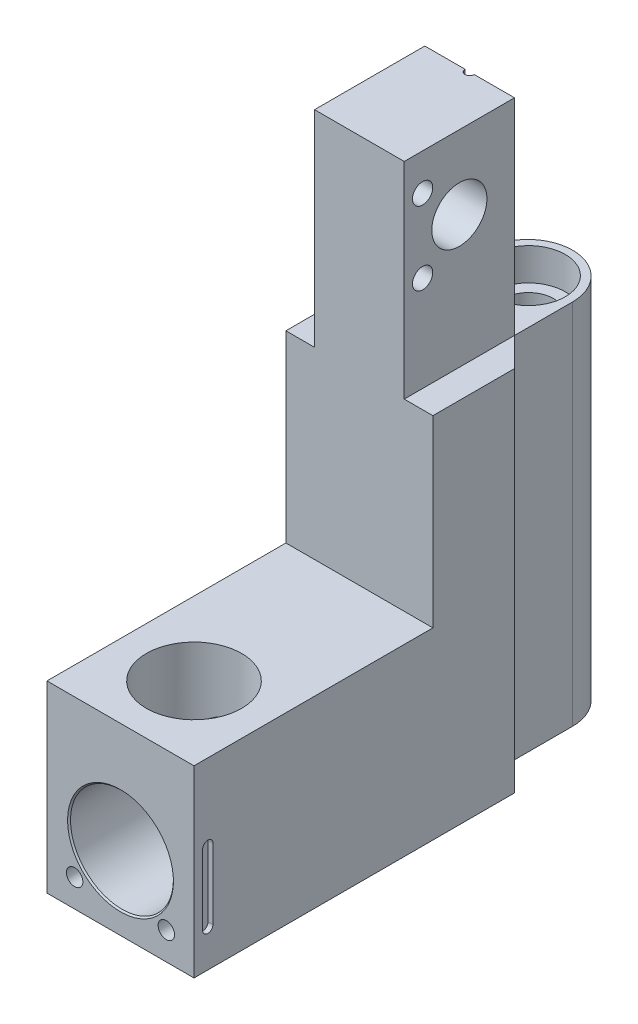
SolidWorks part; units mm, degrees
ref_plane "Front Plane" through (0, 0, 0) normal (0, 0, 1) x (1, 0, 0)
ref_plane "Top Plane" through (0, 0, 0) normal (0, 1, 0) x (1, 0, 0)
ref_plane "Right Plane" through (0, 0, 0) normal (1, 0, 0) x (0, 0, -1)
sketch "Sketch1" plane through (0, 0, 0) normal (0, 1, 0) x (1, 0, 0)
  line L0 (-7.747, 0) -> (-12.7, 0)
  line L1 (7.747, 0) -> (7.747, 17.78)
  line L2 (7.747, 17.78) -> (-7.747, 17.78)
  line L3 (-7.747, 17.78) -> (-7.747, 0)
  line L4 (-12.7, 0) -> (-12.7, -60.325)
  line L5 (-12.7, -60.325) -> (12.7, -60.325)
  line L6 (0, 0) -> (0, -9.7499) construction
  line L7 (7.747, 0) -> (12.7, 0)
  line L8 (12.7, 0) -> (12.7, -60.325)
  point P12 (0, -60.325)
  dimension "D1" = 17.78
  dimension "D2" = 15.494
  dimension "D3" = 25.4
  dimension "D4" = 60.325
extrude "Extrude1" add sketch "Sketch1" along normal blind 63.5
sketch "Sketch2" plane through (0, 63.5, 0) normal (0, 1, 0) x (-1, 0, 0)
  circle A0 centre (0, -10.16) radius 6.35
extrude "Cut-Extrude1" cut sketch "Sketch2" against normal blind 5.588
sketch "Sketch3" plane through (0, 57.912, 0) normal (0, 1, 0) x (-1, 0, 0)
  circle A0 centre (0, -10.16) radius 4.318
extrude "Cut-Extrude2" cut sketch "Sketch3" against normal blind 50.8
sketch "Sketch4" plane through (0, 0, 60.325) normal (0, 0, 1) x (1, 0, 0)
  circle A0 centre (0, 12.7) radius 3.81
extrude "Cut-Extrude3" cut sketch "Sketch4" against normal blind 69.85
sketch "Sketch6" plane through (0, 63.5, 0) normal (0, 1, 0) x (-1, 0, 0)
  line L0 (12.7, 0) -> (12.7, 60.325) construction
  line L1 (-12.7, 60.325) -> (12.7, 60.325)
  line L2 (-12.7, 60.325) -> (-12.7, 19.05)
  line L3 (-12.7, 19.05) -> (12.7, 19.05)
  line L4 (12.7, 60.325) -> (12.7, 19.05)
extrude "Cut-Extrude5" cut sketch "Sketch6" against normal blind 31.75
sketch "Sketch7" plane through (0, 31.75, 0) normal (0, 1, 0) x (-1, 0, 0)
  circle A0 centre (0, 47.625) radius 8.2296
extrude "Cut-Extrude6" cut sketch "Sketch7" against normal blind 17.78
sketch "Sketch9" plane through (0, 0, 60.325) normal (0, 0, 1) x (1, 0, 0)
  circle A0 centre (0, 12.7) radius 8.89
extrude "Cut-Extrude8" cut sketch "Sketch9" against normal blind 38.1
sketch "Sketch10" plane through (0, 63.5, 0) normal (0, 1, 0) x (-1, 0, 0)
  line L0 (0, 0) -> (0, 4.0796) construction
  line L1 (7.747, 0) -> (7.747, 19.05)
  line L3 (-7.747, 19.05) -> (7.747, 19.05)
  line L4 (-7.747, 0) -> (-7.747, 19.05)
  line L5 (0.7938, 0) -> (7.747, 0)
  line L6 (-0.7938, 0) -> (-7.747, 0)
  arc A0 (0.7938, 0) -> (-0.7938, 0) centre (0, 0) ccw
extrude "Extrude2" add sketch "Sketch10" along normal blind 35.56
sketch "Sketch11" plane through (-7.747, 0, 0) normal (-1, 0, 0) x (0, 0, 1)
  circle A0 centre (9.525, 86.36) radius 4.7625
extrude "Cut-Extrude9" cut sketch "Sketch11" against normal through all
fillet "Fillet1" radius 7.747 2 edges at (-7.747, 31.75, -17.78) (7.747, 31.75, -17.78)
sketch "Sketch12" plane through (0, 0, 0) normal (0, -1, 0) x (1, 0, 0)
  line L0 (12.7, 0) -> (12.7, 4.953)
  line L1 (12.7, 60.325) -> (12.7, 0) construction
  line L2 (12.7, 0) -> (7.747, 0)
  line L3 (12.7, 4.953) -> (7.747, 0)
  line L4 (0, 0) -> (0, 4.953) construction
  line L5 (-12.7, 4.953) -> (-7.747, 0)
  line L6 (-12.7, 0) -> (-7.747, 0)
  line L7 (-12.7, 0) -> (-12.7, 4.953)
extrude "Cut-Extrude10" cut sketch "Sketch12" against normal through all
chamfer "Chamfer1" distance 0.254 angle 45 1 edges at (8.89, 12.7, 60.325)
sketch "Sketch13" plane through (0, 0, 60.325) normal (0, 0, 1) x (1, 0, 0)
  circle A1 centre (7.9206, 4.7794) radius 1.4224
  circle A2 centre (-7.9206, 4.7794) radius 1.4224
extrude "Cut-Extrude11" cut sketch "Sketch13" against normal blind 10.16
sketch "Sketch16" plane through (-7.747, 0, 0) normal (-1, 0, 0) x (0, 0, 1)
  line L0 (0, 99.06) -> (19.05, 99.06) construction
  circle A0 centre (15.875, 92.71) radius 1.7526
  circle A1 centre (15.875, 80.01) radius 1.7526
  dimension "D1" = 6.35
  dimension "D2" = 12.7
extrude "Cut-Extrude12" cut sketch "Sketch16" against normal through all
sketch "Sketch17" plane through (12.7, 0, 0) normal (1, 0, 0) x (0, 0, -1)
  line L0 (-60.325, 31.75) -> (-60.325, 0) construction
  line L2 (-60.325, 0) -> (-4.953, 0) construction
  line L5 (-57.0547, 18.542) -> (-57.0547, 6.35)
  line L6 (-58.8327, 18.542) -> (-58.8327, 6.35)
  arc A0 (-57.0547, 18.542) -> (-58.8327, 18.542) centre (-57.9437, 18.542) ccw
  arc A1 (-58.8327, 6.35) -> (-57.0547, 6.35) centre (-57.9437, 6.35) ccw
  dimension "D1" = 2.3813
  dimension "D2" = 6.35
  dimension "D4" = 0.889
  dimension "D3" = 12.192
extrude "Cut-Extrude13" cut sketch "Sketch17" against normal blind 0.8382
sketch "Sketch18" plane through (-12.7, 0, 0) normal (-1, 0, 0) x (0, 0, 1)
  line L0 (4.953, 0) -> (60.325, 0) construction
  line L1 (60.325, 31.75) -> (60.325, 0) construction
  line L2 (58.8315, 18.542) -> (58.8315, 6.35)
  line L3 (57.0535, 18.542) -> (57.0535, 6.35)
  arc A0 (57.0535, 6.35) -> (58.8315, 6.35) centre (57.9425, 6.35) ccw
  arc A1 (58.8315, 18.542) -> (57.0535, 18.542) centre (57.9425, 18.542) ccw
  dimension "D3" = 12.192
  dimension "D1" = 6.35
  dimension "D2" = 2.3825
extrude "Cut-Extrude14" cut sketch "Sketch18" against normal blind 0.8382
